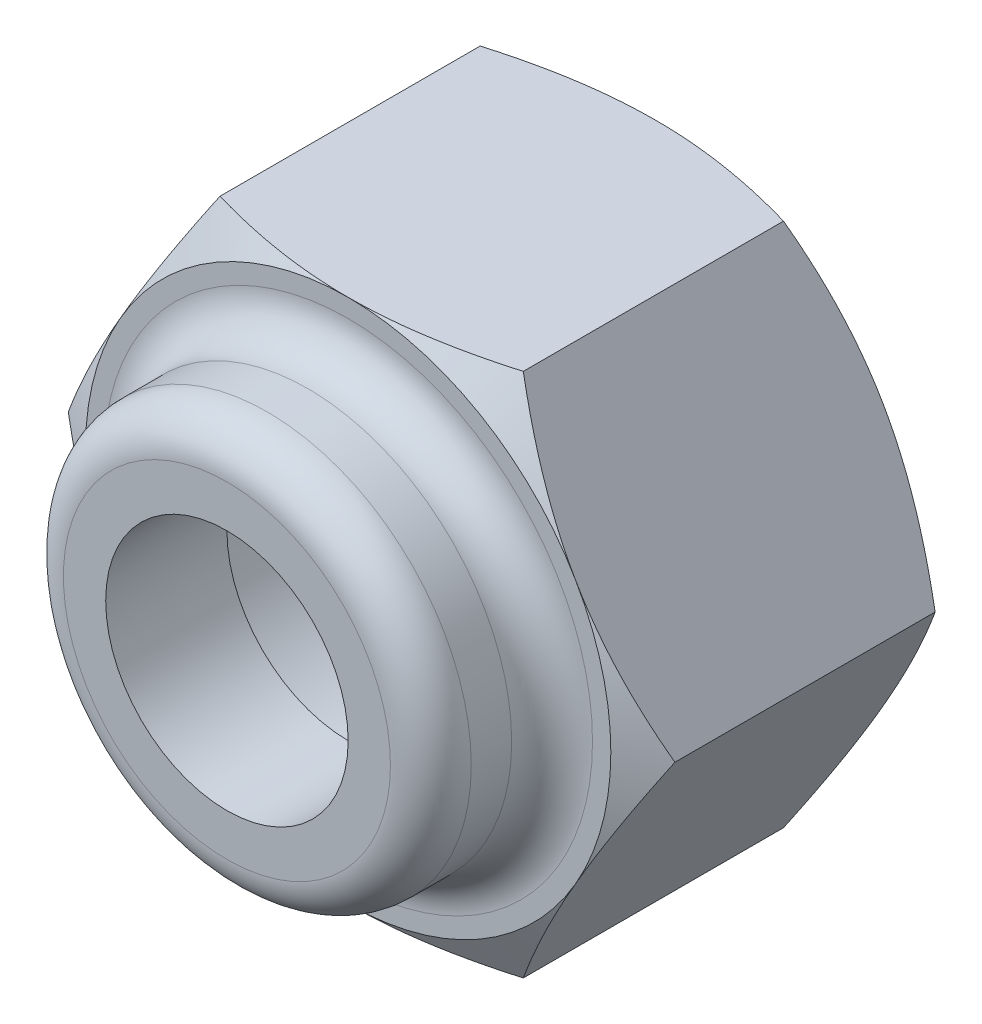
SolidWorks part; units mm, degrees
ref_plane "Plan1" through (0, 0, 0) normal (0, 0, 1) x (1, 0, 0)
ref_plane "Plan2" through (0, 0, 0) normal (0, 1, 0) x (1, 0, 0)
ref_plane "Plan3" through (0, 0, 0) normal (1, 0, 0) x (0, 0, -1)
sketch "Esquisse1" plane through (0, 0, 0) normal (0, 0, 1) x (1, 0, 0)
  line L0 (-3.7528, -6.5) -> (-7.5056, 0)
  line L1 (3.7528, -6.5) -> (-3.7528, -6.5)
  line L2 (7.5056, 0) -> (3.7528, -6.5)
  line L3 (-7.5056, 0) -> (-3.7528, 6.5)
  line L4 (-3.7528, 6.5) -> (3.7528, 6.5)
  line L5 (3.7528, 6.5) -> (7.5056, 0)
  circle A0 centre (0, 0) radius 4
  dimension "D6" = 8
  dimension "D1" = 6.5
  dimension "D2" = 6.5
  dimension "D3" = 6.5
  dimension "D4" = 6.5
  dimension "D5" = 6.5
extrude "Base-Extrusion" add sketch "Esquisse1" along normal blind 7.6
sketch "Esquisse2" plane through (0, 0, 0) normal (0, 0, -1) x (-1, 0, 0)
  line L0 (7.5056, 0) -> (3.7528, 6.5) construction
  circle A0 centre (0, 0) radius 8.952
  circle A1 centre (0, 0) radius 6.5
extrude "Enlèv. mat.-Extru.1" cut sketch "Esquisse2" against normal blind 5 draft 60
sketch "Esquisse3" plane through (0, 0, 7.6) normal (0, 0, 1) x (1, 0, 0)
  line L0 (3.7528, 6.5) -> (7.5056, 0) construction
  circle A0 centre (0, 0) radius 6.5
  circle A1 centre (0, 0) radius 9.1193
extrude "Enlèv. mat.-Extru.2" cut sketch "Esquisse3" against normal blind 5 draft 60
sketch "Esquisse4" plane through (0, 0, 7.6) normal (0, 0, 1) x (1, 0, 0)
  circle A0 centre (0, 0) radius 5.0461
  circle A1 centre (0, 0) radius 3
extrude "Boss.-Extru.1" add sketch "Esquisse4" along normal blind 3
fillet "Congé2" radius 1
fillet "Congé3" radius 1
